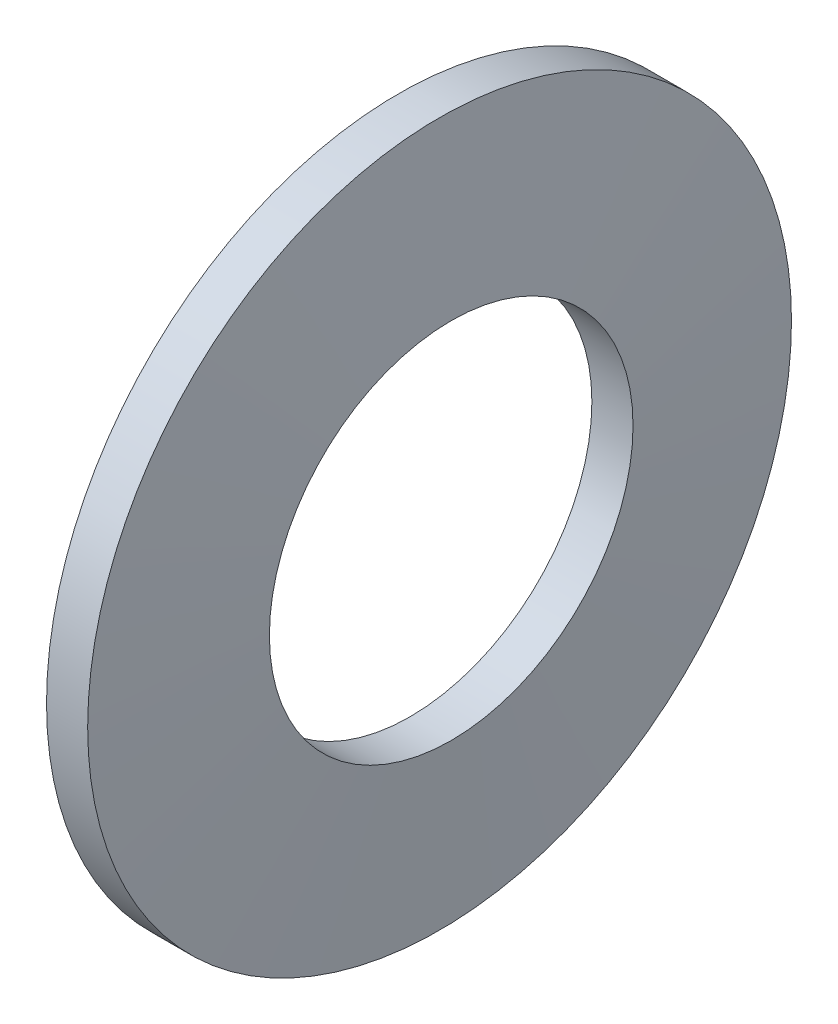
SolidWorks part; units mm, degrees
ref_plane "Face" through (0, 0, 0) normal (0, 0, 1) x (1, 0, 0)
ref_plane "Dessus" through (0, 0, 0) normal (0, 1, 0) x (1, 0, 0)
ref_plane "Droite" through (0, 0, 0) normal (1, 0, 0) x (0, 0, -1)
sketch "Esquisse1" plane through (0, 0, 0) normal (0, 0, 1) x (1, 0, 0)
  line L0 (0, 0) -> (18.6644, 0) construction
  line L1 (0, 30) -> (3.5082, 30)
  line L2 (3.5082, 30) -> (4.5, 15.5)
  line L3 (4.5, 15.5) -> (0.9918, 15.5)
  line L4 (0.9918, 15.5) -> (0, 30)
  line L5 (0, 0) -> (0, 36.9517) construction
  dimension "D1" = 60
  dimension "D2" = 3.5
  dimension "D3" = 4.5
  dimension "D4" = 31
revolve "Base-Révolution" add sketch "Esquisse1" angle 360 about L0
